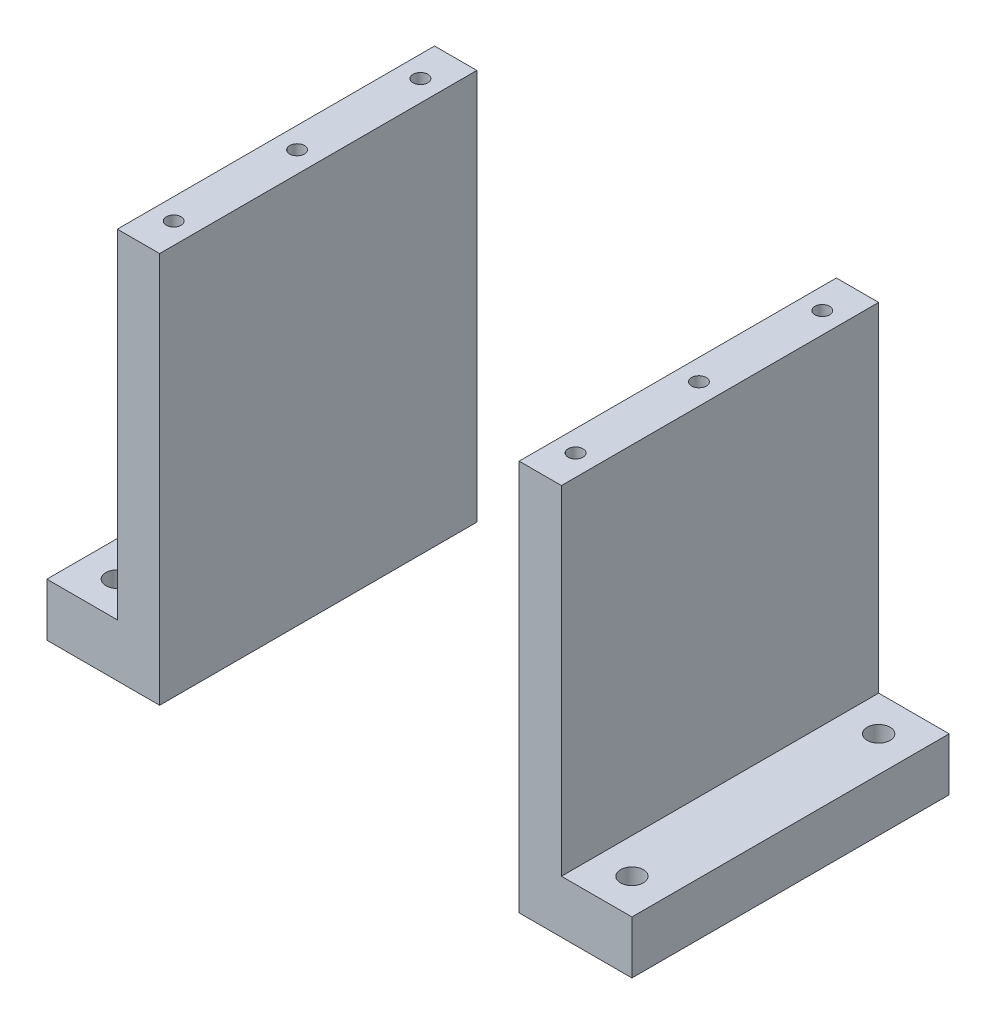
SolidWorks part; units mm, degrees
ref_plane "前视基准面" through (0, 0, 0) normal (0, 0, 1) x (1, 0, 0)
ref_plane "上视基准面" through (0, 0, 0) normal (0, 1, 0) x (1, 0, 0)
ref_plane "右视基准面" through (0, 0, 0) normal (1, 0, 0) x (0, 0, -1)
sketch "草图1" plane through (0, 0, 0) normal (0, 0, 1) x (1, 0, 0)
  line L0 (20, 15) -> (20, 111)
  line L1 (32, 0) -> (32, 111)
  line L2 (0, 0) -> (0, 15)
  line L3 (134, 0) -> (134, 111)
  line L4 (146, 15) -> (146, 111)
  line L5 (166, 0) -> (166, 15)
  line L6 (0, 0) -> (32, 0)
  line L7 (20, 111) -> (32, 111)
  line L8 (134, 111) -> (146, 111)
  line L9 (134, 0) -> (166, 0)
  line L10 (0, 15) -> (20, 15)
  line L11 (146, 15) -> (166, 15)
extrude "凸台-拉伸1" add sketch "草图1" along normal blind 90
sketch "草图2" plane through (0, 15, 0) normal (0, 1, 0) x (1, 0, 0)
  circle A0 centre (10, -10) radius 3.25
  circle A1 centre (10, -80) radius 3.25
  circle A2 centre (156, -80) radius 3.25
  circle A3 centre (156, -10) radius 3.25
extrude "切除-拉伸1" cut sketch "草图2" against normal blind 90
sketch "草图3" plane through (0, 111, 0) normal (0, 1, 0) x (1, 0, 0)
  circle A0 centre (26, -10) radius 2.1
  circle A1 centre (26, -45) radius 2.1
  circle A2 centre (26, -80) radius 2.1
  circle A3 centre (140, -80) radius 2.1
  circle A4 centre (140, -45) radius 2.1
  circle A5 centre (140, -10) radius 2.1
extrude "切除-拉伸2" cut sketch "草图3" against normal blind 15
